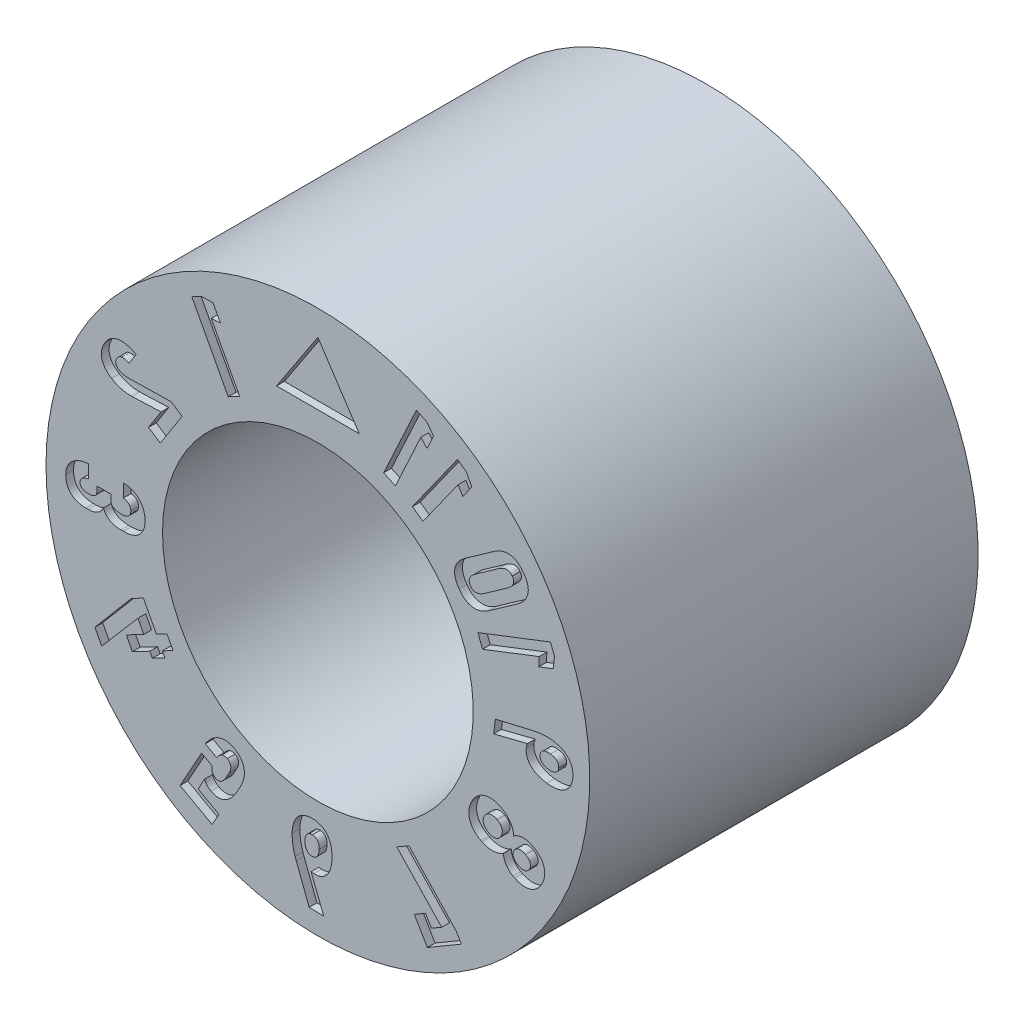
SolidWorks part; units mm, degrees
ref_plane "Front Plane" through (0, 0, 0) normal (0, 0, 1) x (1, 0, 0)
ref_plane "Top Plane" through (0, 0, 0) normal (0, 1, 0) x (1, 0, 0)
ref_plane "Right Plane" through (0, 0, 0) normal (1, 0, 0) x (0, 0, -1)
imported_body "Imported1"
other "Move Face1" parameters "D1"=0.22
other "DeleteFace2"
sketch "Sketch1" plane through (0, 0, 0) normal (0, 0, 1) x (1, 0, 0)
  line L0 (0, 0) -> (5.1041, 2.9469) construction
  line L1 (0, 0) -> (5.8937, 0) construction
  line L2 (0, 0) -> (5.1041, -2.9469) construction
  line L3 (0, 0) -> (2.9469, -5.1041) construction
  line L4 (0, 0) -> (0, -5.8937) construction
  line L5 (0, 0) -> (-2.9469, -5.1041) construction
  line L6 (0, 0) -> (-5.1041, -2.9469) construction
  line L7 (0, 0) -> (-5.8937, 0) construction
  line L8 (0, 0) -> (-5.1041, 2.9469) construction
  line L9 (0, 0) -> (-2.9469, 5.1041) construction
  line L10 (0, 0) -> (0, 5.8937) construction
  line L11 (0, 0) -> (2.9469, 5.1041) construction
  line L12 (2.0596, 0.9126) -> (2.1197, 0.7575)
  line L13 (2.1197, 0.7575) -> (2.8475, 1.0395)
  line L14 (2.8475, 1.0395) -> (2.8431, 0.9225)
  line L15 (2.8431, 0.9225) -> (3.0303, 0.995)
  line L16 (3.0303, 0.995) -> (3.0457, 1.1423)
  line L17 (3.0457, 1.1423) -> (2.9943, 1.2749)
  line L18 (2.9943, 1.2749) -> (2.0596, 0.9126)
  line L19 (2.2015, 1.2279) -> (2.5719, 1.4891)
  line L20 (2.267, 1.9211) -> (1.8966, 1.66)
  line L21 (2.0317, 1.5515) -> (2.3238, 1.7575)
  line L22 (2.4366, 1.5976) -> (2.1446, 1.3916)
  line L23 (1.2165, 1.8962) -> (1.3528, 1.7993)
  line L24 (1.3528, 1.7993) -> (1.8046, 2.4341)
  line L25 (1.8046, 2.4341) -> (1.8657, 2.334)
  line L26 (1.8657, 2.334) -> (1.9819, 2.4971)
  line L27 (1.9819, 2.4971) -> (1.9132, 2.629)
  line L28 (1.9132, 2.629) -> (1.7969, 2.7117)
  line L29 (1.7969, 2.7117) -> (1.2165, 1.8962)
  line L30 (0.8469, 2.0879) -> (0.9985, 2.0175)
  line L31 (0.9985, 2.0175) -> (1.3262, 2.7243)
  line L32 (1.3262, 2.7243) -> (1.4052, 2.6369)
  line L33 (1.4052, 2.6369) -> (1.4894, 2.8185)
  line L34 (1.4894, 2.8185) -> (1.3975, 2.9354)
  line L35 (1.3975, 2.9354) -> (1.2679, 2.9955)
  line L36 (1.2679, 2.9955) -> (0.8469, 2.0879)
  line L37 (-1.1539, 1.9352) -> (-1.0071, 2.0134)
  line L38 (-1.0071, 2.0134) -> (-1.372, 2.6989)
  line L39 (-1.372, 2.6989) -> (-1.2558, 2.7085)
  line L40 (-1.2558, 2.7085) -> (-1.3495, 2.8848)
  line L41 (-1.3495, 2.8848) -> (-1.4972, 2.8823)
  line L42 (-1.4972, 2.8823) -> (-1.6225, 2.8155)
  line L43 (-1.6225, 2.8155) -> (-1.1539, 1.9352)
  line L44 (-1.8903, 1.5123) -> (-2.4338, 1.5014)
  line L45 (-2.5595, 1.5311) -> (-2.5608, 1.5319)
  line L46 (-2.4326, 1.6703) -> (-2.4323, 1.67)
  line L47 (-2.4323, 1.67) -> (-2.3405, 1.8135)
  line L48 (-2.3405, 1.8135) -> (-2.3408, 1.8138)
  line L49 (-2.6576, 1.391) -> (-2.657, 1.3907)
  line L50 (-2.3979, 1.3187) -> (-2.0188, 1.3335)
  line L51 (-2.0188, 1.3335) -> (-2.181, 1.0802)
  line L52 (-2.181, 1.0802) -> (-2.0279, 0.982)
  line L53 (-2.0279, 0.982) -> (-1.7471, 1.4206)
  line L54 (-1.7471, 1.4206) -> (-1.8903, 1.5123)
  line L55 (-2.5038, 0.301) -> (-2.5047, 0.1299)
  line L56 (-2.5227, -0.0611) -> (-2.5461, -0.0611)
  line L57 (-2.6647, 0.02) -> (-2.6644, 0.0944)
  line L58 (-2.6644, 0.0944) -> (-2.846, 0.0952)
  line L59 (-2.846, 0.0952) -> (-2.8463, 0.0208)
  line L60 (-2.9497, -0.0446) -> (-2.967, -0.0447)
  line L61 (-2.9517, 0.1182) -> (-2.951, 0.2888)
  line L62 (-2.9869, -0.2224) -> (-2.9568, -0.2225)
  line L63 (-2.5324, -0.2392) -> (-2.5023, -0.2393)
  line L64 (-2.3998, -0.9363) -> (-2.8705, -1.4918)
  line L65 (-2.8705, -1.4918) -> (-2.7826, -1.6597)
  line L66 (-2.7826, -1.6597) -> (-2.3158, -1.1144)
  line L67 (-2.3158, -1.1144) -> (-2.2263, -1.2853)
  line L68 (-2.1308, -1.4677) -> (-1.9694, -1.3832)
  line L69 (-1.9694, -1.3832) -> (-2.0017, -1.3216)
  line L70 (-2.2458, -0.8556) -> (-2.3998, -0.9363)
  line L71 (-2.4656, -1.3755) -> (-2.388, -1.5239)
  line L72 (-2.388, -1.5239) -> (-2.163, -1.4061)
  line L73 (-1.8648, -1.2499) -> (-1.9425, -1.1015)
  line L74 (-1.9425, -1.1015) -> (-2.0794, -1.1733)
  line L75 (-1.4487, -2.0806) -> (-1.449, -2.0813)
  line L76 (-1.449, -2.0813) -> (-1.304, -2.1615)
  line L77 (-1.304, -2.1615) -> (-1.3037, -2.1608)
  line L78 (-1.145, -2.2571) -> (-1.1854, -2.33)
  line L79 (-1.3618, -2.2833) -> (-1.4972, -2.2085)
  line L80 (-1.4972, -2.2085) -> (-1.7741, -2.7093)
  line L81 (-1.7741, -2.7093) -> (-1.3609, -2.9376)
  line L82 (-1.3609, -2.9376) -> (-1.2735, -2.7797)
  line L83 (-1.2735, -2.7797) -> (-1.5417, -2.6315)
  line L84 (-1.5417, -2.6315) -> (-1.4567, -2.4774)
  line L85 (-1.0404, -2.4102) -> (-1, -2.3372)
  line L86 (-0.332, -2.5204) -> (-0.332, -2.521)
  line L87 (-0.2788, -2.8001) -> (-0.1124, -3.2356)
  line L88 (-0.1124, -3.2356) -> (0.0751, -3.2409)
  line L89 (0.0751, -3.2409) -> (-0.0872, -2.8268)
  line L91 (0.1826, -2.539) -> (0.1826, -2.5384)
  line L92 (0.0172, -2.5221) -> (0.0174, -2.5227)
  line L93 (-0.1662, -2.517) -> (-0.1662, -2.5161)
  line L94 (1.7844, -2.5592) -> (1.1725, -1.9071)
  line L95 (1.1725, -1.9071) -> (1.0158, -1.9987)
  line L96 (1.0158, -1.9987) -> (1.594, -2.6053)
  line L97 (1.594, -2.6053) -> (1.4618, -2.6824)
  line L98 (1.4618, -2.6824) -> (1.3861, -2.553)
  line L99 (1.3861, -2.553) -> (1.2415, -2.6376)
  line L100 (1.2415, -2.6376) -> (1.4085, -2.9234)
  line L101 (1.4085, -2.9234) -> (1.8473, -2.6669)
  line L102 (1.8473, -2.6669) -> (1.7844, -2.5592)
  line L103 (2.0995, -1.3854) -> (2.1142, -1.3928)
  line L104 (2.5113, -1.5747) -> (2.5345, -1.5865)
  line L105 (2.7723, -1.1198) -> (2.7491, -1.108)
  line L106 (2.3685, -0.8935) -> (2.3538, -0.886)
  line L107 (2.3027, -1.0469) -> (2.3112, -1.0513)
  line L108 (2.2075, -1.2536) -> (2.1983, -1.2489)
  line L109 (2.6667, -1.2529) -> (2.6754, -1.2572)
  line L110 (2.5881, -1.4269) -> (2.5789, -1.4223)
  line L112 (2.9453, -0.3217) -> (2.9458, -0.3219)
  line L113 (3.0065, 0.1932) -> (3.0059, 0.1934)
  line L114 (2.729, 0.1652) -> (2.2849, 0.0609)
  line L115 (2.2849, 0.0609) -> (2.2631, -0.1145)
  line L116 (2.2631, -0.1145) -> (2.6988, -0.0049)
  line L117 (2.9939, 0.0266) -> (2.9947, 0.0266)
  line L118 (2.9711, -0.1568) -> (2.9705, -0.1566)
  line L119 (-2.2407, -1.2577) -> (-2.4656, -1.3755)
  line L120 (-2.0685, -1.1942) -> (-2.2458, -0.8556)
  line L121 (-2.0017, -1.3216) -> (-1.8648, -1.2499)
  line L122 (-2.163, -1.4061) -> (-2.1308, -1.4677)
  circle A0 centre (0, 0) radius 2.26 construction
  spline S0 degree 3 poles (1.8175, 1.2806) (1.8291, 1.2639) (1.8482, 1.2409) (1.8763, 1.2142) (1.898, 1.1981) (1.9203, 1.1845) (1.9436, 1.1744) (1.9676, 1.1668) (1.9924, 1.1624) (2.0176, 1.1608) (2.0432, 1.1621) (2.0691, 1.1663) (2.0953, 1.1729) (2.1216, 1.1827) (2.1582, 1.1993) (2.1842, 1.2159) (2.2015, 1.2279) knots 0 0 0 0 0.138223 0.202127 0.26303 0.321891 0.378837 0.435678 0.492307 0.549453 0.60742 0.666308 0.727523 0.790486 0.856773 1 1 1 1
  spline S1 degree 3 poles (2.5719, 1.4891) (2.5892, 1.5013) (2.6134, 1.5207) (2.6419, 1.5494) (2.6599, 1.5712) (2.6751, 1.5936) (2.6875, 1.6166) (2.697, 1.6404) (2.704, 1.6647) (2.7081, 1.6894) (2.7089, 1.7145) (2.7068, 1.7398) (2.7017, 1.7653) (2.6935, 1.7909) (2.6781, 1.8263) (2.6626, 1.8517) (2.651, 1.8683) knots 0 0 0 0 0.143936 0.210679 0.274525 0.335577 0.39443 0.45221 0.50914 0.565942 0.622178 0.679438 0.738053 0.798374 0.8621 1 1 1 1
  spline S2 degree 3 poles (2.651, 1.8683) (2.6391, 1.8848) (2.6206, 1.9083) (2.592, 1.9344) (2.5707, 1.951) (2.5483, 1.9643) (2.5254, 1.9751) (2.5014, 1.9824) (2.4768, 1.9871) (2.4517, 1.9888) (2.4262, 1.9877) (2.4003, 1.9835) (2.3741, 1.9767) (2.3476, 1.9671) (2.3108, 1.95) (2.2844, 1.9334) (2.267, 1.9211) knots 0 0 0 0 0.138285 0.201935 0.262466 0.32126 0.378216 0.434531 0.491022 0.547533 0.605259 0.664079 0.724843 0.788739 0.855272 1 1 1 1
  spline S3 degree 3 poles (1.8966, 1.66) (1.8794, 1.6476) (1.8549, 1.6284) (1.8264, 1.5997) (1.8087, 1.5777) (1.7932, 1.5556) (1.7808, 1.5325) (1.7713, 1.5087) (1.7643, 1.4844) (1.7605, 1.4597) (1.7594, 1.4346) (1.7615, 1.4093) (1.7669, 1.3838) (1.7749, 1.358) (1.7904, 1.3226) (1.8058, 1.2971) (1.8175, 1.2806) knots 0 0 0 0 0.144056 0.21075 0.274393 0.335517 0.394327 0.452064 0.508951 0.565796 0.621851 0.679069 0.737879 0.798524 0.862202 1 1 1 1
  spline S4 degree 3 poles (1.9654, 1.3849) (1.9563, 1.397) (1.9473, 1.4179) (1.9471, 1.4476) (1.9539, 1.4689) (1.9658, 1.4901) (1.9906, 1.5196) (2.0139, 1.5394) (2.0317, 1.5515) knots 0 0 0 0 0.222988 0.325304 0.431966 0.550057 0.682242 1 1 1 1
  spline S5 degree 3 poles (2.3238, 1.7575) (2.3413, 1.7699) (2.3676, 1.7856) (2.4038, 1.7986) (2.4276, 1.803) (2.45, 1.802) (2.4781, 1.7923) (2.4944, 1.7761) (2.503, 1.7639) knots 0 0 0 0 0.31819 0.449664 0.567045 0.673853 0.777329 1 1 1 1
  spline S6 degree 3 poles (2.503, 1.7639) (2.5115, 1.7517) (2.5216, 1.731) (2.521, 1.7014) (2.5144, 1.6801) (2.5025, 1.659) (2.4781, 1.6292) (2.4542, 1.61) (2.4366, 1.5976) knots 0 0 0 0 0.222263 0.325328 0.432124 0.549372 0.681391 1 1 1 1
  spline S7 degree 3 poles (2.1446, 1.3916) (2.1272, 1.379) (2.1008, 1.3636) (2.0647, 1.3501) (2.0407, 1.346) (2.0183, 1.3468) (1.9905, 1.357) (1.9737, 1.3723) (1.9654, 1.3849) knots 0 0 0 0 0.317667 0.449809 0.568102 0.674939 0.777435 1 1 1 1
  spline S8 degree 3 poles (-2.4338, 1.5014) (-2.4572, 1.5008) (-2.501, 1.5049) (-2.5424, 1.5201) (-2.5595, 1.5311) knots 0 0 0 0 0.536929 1 1 1 1
  spline S9 degree 3 poles (-2.5608, 1.5319) (-2.5709, 1.5385) (-2.5851, 1.5498) (-2.5967, 1.5698) (-2.6018, 1.585) (-2.6029, 1.6012) (-2.5996, 1.6247) (-2.5912, 1.6413) (-2.5845, 1.652) knots 0 0 0 0 0.263365 0.379677 0.493234 0.607245 0.727117 1 1 1 1
  spline S10 degree 3 poles (-2.5845, 1.652) (-2.5777, 1.6627) (-2.5644, 1.6769) (-2.5413, 1.688) (-2.5223, 1.6923) (-2.5017, 1.6925) (-2.4706, 1.6877) (-2.4478, 1.6781) (-2.4326, 1.6703) knots 0 0 0 0 0.225248 0.334561 0.44738 0.567858 0.697098 1 1 1 1
  spline S11 degree 3 poles (-2.3408, 1.8138) (-2.3664, 1.8283) (-2.4056, 1.8462) (-2.4593, 1.8617) (-2.4975, 1.8681) (-2.5344, 1.8697) (-2.5698, 1.8664) (-2.6034, 1.8586) (-2.635, 1.8459) (-2.6644, 1.8285) (-2.7013, 1.7993) (-2.7238, 1.7711) (-2.7369, 1.7509) knots 0 0 0 0 0.196899 0.287244 0.373418 0.455611 0.534164 0.610264 0.685866 0.761776 0.838126 1 1 1 1
  spline S12 degree 3 poles (-2.7369, 1.7509) (-2.7508, 1.7294) (-2.768, 1.696) (-2.7826, 1.6497) (-2.7878, 1.6164) (-2.7882, 1.5838) (-2.784, 1.552) (-2.7747, 1.5215) (-2.7604, 1.4922) (-2.7416, 1.4641) (-2.7092, 1.4277) (-2.6792, 1.4048) (-2.6576, 1.391) knots 0 0 0 0 0.183427 0.266802 0.346802 0.424263 0.499506 0.575107 0.651975 0.732263 0.816125 1 1 1 1
  spline S13 degree 3 poles (-2.657, 1.3907) (-2.6377, 1.3785) (-2.6076, 1.3622) (-2.565, 1.3452) (-2.5319, 1.3348) (-2.4982, 1.3267) (-2.4537, 1.3195) (-2.4201, 1.3182) (-2.3979, 1.3187) knots 0 0 0 0 0.250313 0.376091 0.5041 0.631293 0.756247 1 1 1 1
  spline S14 degree 3 poles (-2.2252, 0.0178) (-2.2251, 0.0431) (-2.2284, 0.0807) (-2.2424, 0.1279) (-2.2568, 0.1604) (-2.275, 0.1903) (-2.2974, 0.2169) (-2.3233, 0.2406) (-2.3533, 0.2606) (-2.3865, 0.2771) (-2.4363, 0.2941) (-2.4763, 0.2998) (-2.5038, 0.301) knots 0 0 0 0 0.170884 0.251894 0.331445 0.409877 0.486903 0.565434 0.646124 0.729112 0.814592 1 1 1 1
  spline S15 degree 3 poles (-2.5047, 0.1299) (-2.4949, 0.1288) (-2.4809, 0.1259) (-2.4636, 0.1195) (-2.452, 0.114) (-2.442, 0.107) (-2.4329, 0.0997) (-2.4254, 0.0911) (-2.4191, 0.0818) (-2.4141, 0.0717) (-2.4093, 0.0569) (-2.408, 0.045) (-2.408, 0.037) knots 0 0 0 0 0.197799 0.288205 0.373638 0.455965 0.53409 0.609983 0.685076 0.76067 0.837589 1 1 1 1
  spline S16 degree 3 poles (-2.408, 0.037) (-2.4082, 0.0228) (-2.4111, 0.0017) (-2.4247, -0.0222) (-2.4382, -0.0365) (-2.4549, -0.048) (-2.483, -0.059) (-2.5065, -0.0613) (-2.5227, -0.0611) knots 0 0 0 0 0.249982 0.362912 0.475786 0.591998 0.715765 1 1 1 1
  spline S17 degree 3 poles (-2.5461, -0.0611) (-2.5631, -0.0611) (-2.5873, -0.0587) (-2.6168, -0.0499) (-2.634, -0.0404) (-2.6481, -0.0289) (-2.6614, -0.0094) (-2.6649, 0.0082) (-2.6647, 0.02) knots 0 0 0 0 0.314658 0.447802 0.567895 0.67794 0.781079 1 1 1 1
  spline S18 degree 3 poles (-2.8463, 0.0208) (-2.8465, 0.0112) (-2.8492, -0.0037) (-2.8617, -0.0191) (-2.8738, -0.0286) (-2.889, -0.0359) (-2.9143, -0.0434) (-2.9352, -0.0445) (-2.9497, -0.0446) knots 0 0 0 0 0.212077 0.314905 0.425831 0.547439 0.681377 1 1 1 1
  spline S19 degree 3 poles (-2.967, -0.0447) (-2.9807, -0.0447) (-3.0004, -0.0428) (-3.0242, -0.0345) (-3.0382, -0.0258) (-3.0495, -0.0153) (-3.0601, 0.0025) (-3.0632, 0.0179) (-3.0629, 0.0284) knots 0 0 0 0 0.30162 0.431712 0.550476 0.661572 0.769065 1 1 1 1
  spline S20 degree 3 poles (-3.0629, 0.0284) (-3.0629, 0.0357) (-3.061, 0.0464) (-3.0557, 0.06) (-3.0498, 0.0696) (-3.0423, 0.0784) (-3.0335, 0.0866) (-3.0232, 0.094) (-3.0115, 0.1006) (-2.9983, 0.1063) (-2.9785, 0.1131) (-2.9627, 0.1167) (-2.9517, 0.1182) knots 0 0 0 0 0.139325 0.208052 0.279596 0.35394 0.429788 0.51113 0.597261 0.689146 0.78635 1 1 1 1
  spline S21 degree 3 poles (-2.951, 0.2888) (-2.9798, 0.2867) (-3.0216, 0.28) (-3.0739, 0.263) (-3.1089, 0.2471) (-3.1403, 0.2279) (-3.168, 0.2058) (-3.1917, 0.1808) (-3.2112, 0.153) (-3.2267, 0.1232) (-3.2415, 0.0803) (-3.2458, 0.0463) (-3.246, 0.0233) knots 0 0 0 0 0.196375 0.287327 0.374343 0.457998 0.53764 0.615312 0.69188 0.768102 0.843822 1 1 1 1
  spline S22 degree 3 poles (-3.246, 0.0233) (-3.2459, 0.005) (-3.2445, -0.0221) (-3.2372, -0.0566) (-3.23, -0.0802) (-3.2206, -0.1021) (-3.2089, -0.1223) (-3.1951, -0.1409) (-3.1793, -0.1579) (-3.1615, -0.173) (-3.1417, -0.186) (-3.1204, -0.1974) (-3.097, -0.2062) (-3.072, -0.2135) (-3.0352, -0.2205) (-3.0065, -0.2223) (-2.9869, -0.2224) knots 0 0 0 0 0.136021 0.199203 0.259815 0.317992 0.375128 0.431724 0.488506 0.545872 0.603904 0.663145 0.724276 0.788303 0.855124 1 1 1 1
  spline S23 degree 3 poles (-2.9568, -0.2225) (-2.9349, -0.2226) (-2.9027, -0.2195) (-2.8625, -0.2064) (-2.8354, -0.193) (-2.8109, -0.1761) (-2.7825, -0.1484) (-2.7663, -0.1231) (-2.7581, -0.1048) knots 0 0 0 0 0.267864 0.392553 0.515693 0.636182 0.75559 1 1 1 1
  spline S24 degree 3 poles (-2.7581, -0.1048) (-2.7554, -0.1151) (-2.7503, -0.1302) (-2.7403, -0.1487) (-2.7315, -0.1616) (-2.7214, -0.1736) (-2.7099, -0.1846) (-2.6971, -0.1948) (-2.678, -0.2072) (-2.6512, -0.2202) (-2.601, -0.2352) (-2.5604, -0.2389) (-2.5324, -0.2392) knots 0 0 0 0 0.112513 0.167441 0.22159 0.276546 0.332896 0.390174 0.448904 0.572816 0.703834 1 1 1 1
  spline S25 degree 3 poles (-2.5023, -0.2393) (-2.4752, -0.2395) (-2.4355, -0.2366) (-2.3859, -0.2236) (-2.3531, -0.2105) (-2.3236, -0.1938) (-2.2978, -0.1734) (-2.2757, -0.1493) (-2.2575, -0.1218) (-2.2431, -0.0911) (-2.2289, -0.0448) (-2.2253, -0.0076) (-2.2252, 0.0178) knots 0 0 0 0 0.189541 0.275648 0.357338 0.435385 0.511642 0.586239 0.662707 0.741054 0.822273 1 1 1 1
  spline S26 degree 3 poles (-1.0793, -1.9447) (-1.0991, -1.9338) (-1.1305, -1.9209) (-1.1746, -1.9139) (-1.2077, -1.9135) (-1.241, -1.9175) (-1.2738, -1.9267) (-1.306, -1.941) (-1.3374, -1.9598) (-1.3679, -1.9833) (-1.4075, -2.022) (-1.4332, -2.056) (-1.4487, -2.0806) knots 0 0 0 0 0.154801 0.229683 0.305088 0.381101 0.458281 0.537806 0.621617 0.709067 0.800913 1 1 1 1
  spline S27 degree 3 poles (-1.3037, -2.1608) (-1.2946, -2.1469) (-1.2791, -2.1285) (-1.2551, -2.1096) (-1.2371, -2.1003) (-1.2189, -2.0946) (-1.194, -2.0935) (-1.1759, -2.099) (-1.1651, -2.1052) knots 0 0 0 0 0.30142 0.431347 0.552466 0.666341 0.774979 1 1 1 1
  spline S28 degree 3 poles (-1.1651, -2.1052) (-1.1537, -2.1115) (-1.138, -2.1241) (-1.1257, -2.1471) (-1.1211, -2.1662) (-1.1205, -2.1871) (-1.1262, -2.2186) (-1.1366, -2.2417) (-1.145, -2.2571) knots 0 0 0 0 0.228345 0.335792 0.447196 0.566011 0.695359 1 1 1 1
  spline S29 degree 3 poles (-1.1854, -2.33) (-1.1939, -2.3453) (-1.2076, -2.3664) (-1.2305, -2.3883) (-1.2473, -2.3995) (-1.2645, -2.4065) (-1.2883, -2.4087) (-1.3058, -2.4041) (-1.316, -2.3979) knots 0 0 0 0 0.317961 0.451111 0.571891 0.682328 0.785376 1 1 1 1
  spline S30 degree 3 poles (-1.316, -2.3979) (-1.3256, -2.3923) (-1.3393, -2.3826) (-1.3525, -2.3651) (-1.3597, -2.3508) (-1.3645, -2.3352) (-1.3669, -2.3124) (-1.3647, -2.2949) (-1.3618, -2.2833) knots 0 0 0 0 0.2508 0.368564 0.487845 0.609408 0.732715 1 1 1 1
  spline S31 degree 3 poles (-1.4567, -2.4774) (-1.4545, -2.4868) (-1.449, -2.5007) (-1.438, -2.518) (-1.428, -2.531) (-1.4165, -2.5433) (-1.3999, -2.5575) (-1.3869, -2.5673) (-1.3773, -2.5722) knots 0 0 0 0 0.227991 0.350069 0.48241 0.61661 0.745694 1 1 1 1
  spline S32 degree 3 poles (-1.3773, -2.5722) (-1.3586, -2.5825) (-1.329, -2.5945) (-1.2876, -2.5997) (-1.2574, -2.5986) (-1.2274, -2.5922) (-1.1982, -2.5804) (-1.1693, -2.5641) (-1.1414, -2.5424) (-1.1143, -2.5161) (-1.0782, -2.4732) (-1.0549, -2.4364) (-1.0404, -2.4102) knots 0 0 0 0 0.152248 0.224027 0.294817 0.366823 0.440565 0.518443 0.601923 0.6913 0.786668 1 1 1 1
  spline S33 degree 3 poles (-1, -2.3372) (-0.9856, -2.311) (-0.9671, -2.2713) (-0.9523, -2.2169) (-0.9462, -2.1788) (-0.9456, -2.1421) (-0.9494, -2.1071) (-0.959, -2.0742) (-0.9732, -2.0432) (-0.9925, -2.0145) (-1.0259, -1.9786) (-1.0568, -1.9569) (-1.0793, -1.9447) knots 0 0 0 0 0.198011 0.287205 0.371812 0.452182 0.528627 0.603302 0.677465 0.752855 0.830889 1 1 1 1
  spline S34 degree 3 poles (-0.0665, -2.2257) (-0.0918, -2.2247) (-0.129, -2.2278) (-0.1756, -2.2414) (-0.2066, -2.2564) (-0.2345, -2.2756) (-0.2592, -2.2989) (-0.2803, -2.3265) (-0.298, -2.3582) (-0.3123, -2.3936) (-0.327, -2.4476) (-0.3308, -2.4908) (-0.332, -2.5204) knots 0 0 0 0 0.168783 0.246857 0.322466 0.397014 0.471656 0.547898 0.628096 0.712729 0.802078 1 1 1 1
  spline S35 degree 3 poles (-0.332, -2.521) (-0.3325, -2.5397) (-0.3316, -2.5682) (-0.328, -2.6067) (-0.3188, -2.6681) (-0.3067, -2.719) (-0.2934, -2.759) knots 0 0 0 0 0.231402 0.353128 0.478528 1 1 1 1
  spline S36 degree 3 poles (-0.2934, -2.759) (-0.2914, -2.7661) (-0.2864, -2.7797) (-0.2816, -2.7934) (-0.2788, -2.8001) knots 0 0 0 0 0.503759 1 1 1 1
  spline S37 degree 3 poles (-0.0872, -2.8268) (-0.0767, -2.8294) (-0.0658, -2.8305) (-0.0551, -2.831) knots 0.766156 0.766156 0.766156 0.766156 1 1 1 1
  spline S38 degree 3 poles (-0.0551, -2.831) (-0.0325, -2.8314) (0.0012, -2.8291) (0.0427, -2.815) (0.0706, -2.8005) (0.0954, -2.7813) (0.1176, -2.7581) (0.1363, -2.7306) (0.1522, -2.6993) (0.1647, -2.6641) (0.178, -2.6108) (0.1814, -2.5682) (0.1826, -2.539) knots 0 0 0 0 0.159665 0.233922 0.307095 0.380353 0.454338 0.531615 0.613645 0.70097 0.79394 1 1 1 1
  spline S39 degree 3 poles (0.1826, -2.5384) (0.1835, -2.5085) (0.1816, -2.4647) (0.1702, -2.4094) (0.1582, -2.3727) (0.142, -2.3397) (0.1225, -2.3105) (0.099, -2.2855) (0.0723, -2.2646) (0.042, -2.248) (-0.0038, -2.2314) (-0.041, -2.2263) (-0.0665, -2.2257) knots 0 0 0 0 0.198272 0.288078 0.372761 0.453234 0.530156 0.604522 0.678801 0.753963 0.831855 1 1 1 1
  spline S40 degree 3 poles (-0.0715, -2.4073) (-0.0583, -2.4076) (-0.0387, -2.4113) (-0.0166, -2.4246) (-0.0036, -2.4382) (0.0066, -2.4549) (0.0161, -2.4829) (0.0176, -2.5061) (0.0172, -2.5221) knots 0 0 0 0 0.241904 0.352713 0.464932 0.582425 0.707323 1 1 1 1
  spline S41 degree 3 poles (0.0174, -2.5227) (0.017, -2.5411) (0.0137, -2.5674) (0.0027, -2.5989) (-0.0084, -2.6174) (-0.0224, -2.6319) (-0.0448, -2.6461) (-0.0651, -2.6491) (-0.0784, -2.6488) knots 0 0 0 0 0.309811 0.439793 0.558761 0.668816 0.775224 1 1 1 1
  spline S42 degree 3 poles (-0.0784, -2.6488) (-0.0915, -2.6482) (-0.1115, -2.6443) (-0.1329, -2.6285) (-0.1459, -2.6129) (-0.1555, -2.5934) (-0.1658, -2.5616) (-0.1662, -2.5351) (-0.1662, -2.517) knots 0 0 0 0 0.223451 0.329309 0.440847 0.561748 0.692669 1 1 1 1
  spline S43 degree 3 poles (-0.1662, -2.5161) (-0.1656, -2.5002) (-0.1629, -2.4772) (-0.1515, -2.4501) (-0.1405, -2.4341) (-0.1267, -2.4216) (-0.1043, -2.4092) (-0.0846, -2.407) (-0.0715, -2.4073) knots 0 0 0 0 0.293828 0.418443 0.535396 0.647352 0.757693 1 1 1 1
  spline S44 degree 3 poles (1.9795, -1.0098) (1.9676, -1.0334) (1.953, -1.0698) (1.944, -1.1201) (1.9423, -1.1564) (1.9455, -1.1919) (1.9537, -1.226) (1.9668, -1.2584) (1.9849, -1.2889) (2.007, -1.3175) (2.0435, -1.3526) (2.0762, -1.3734) (2.0995, -1.3854) knots 0 0 0 0 0.178904 0.262277 0.343871 0.423875 0.501818 0.579804 0.659084 0.74032 0.823197 1 1 1 1
  spline S45 degree 3 poles (2.1142, -1.3928) (2.136, -1.4038) (2.1705, -1.4168) (2.2191, -1.4239) (2.2558, -1.4248) (2.2922, -1.4214) (2.3381, -1.4107) (2.3697, -1.3954) (2.3888, -1.3825) knots 0 0 0 0 0.254555 0.380794 0.510158 0.637489 0.760373 1 1 1 1
  spline S46 degree 3 poles (2.3888, -1.3825) (2.3894, -1.4021) (2.3944, -1.4315) (2.4088, -1.4686) (2.4237, -1.495) (2.4414, -1.5196) (2.4689, -1.5487) (2.4938, -1.5654) (2.5113, -1.5747) knots 0 0 0 0 0.246588 0.371108 0.498461 0.62659 0.751508 1 1 1 1
  spline S47 degree 3 poles (2.5345, -1.5865) (2.5565, -1.5976) (2.5906, -1.6108) (2.6376, -1.6195) (2.6717, -1.6208) (2.7048, -1.6173) (2.7369, -1.6099) (2.7672, -1.5972) (2.796, -1.5804) (2.8228, -1.5594) (2.8561, -1.5251) (2.8756, -1.4941) (2.8869, -1.4721) knots 0 0 0 0 0.177626 0.260887 0.342289 0.421964 0.499708 0.578138 0.657657 0.738797 0.822075 1 1 1 1
  spline S48 degree 3 poles (2.8869, -1.4721) (2.8983, -1.4502) (2.9116, -1.416) (2.9199, -1.3689) (2.9213, -1.3348) (2.9179, -1.3017) (2.9102, -1.2697) (2.8976, -1.2393) (2.8807, -1.2105) (2.8595, -1.1839) (2.8252, -1.1506) (2.7943, -1.131) (2.7723, -1.1198) knots 0 0 0 0 0.177737 0.261306 0.342676 0.422322 0.49985 0.578251 0.65774 0.739356 0.822122 1 1 1 1
  spline S49 degree 3 poles (2.7491, -1.108) (2.7312, -1.0987) (2.7025, -1.0888) (2.6625, -1.0833) (2.6321, -1.0837) (2.6021, -1.0879) (2.5637, -1.0986) (2.5371, -1.1121) (2.5209, -1.1233) knots 0 0 0 0 0.251562 0.375939 0.503229 0.630153 0.754335 1 1 1 1
  spline S50 degree 3 poles (2.5209, -1.1233) (2.5204, -1.1) (2.5133, -1.0655) (2.4957, -1.0214) (2.4771, -0.9898) (2.4552, -0.9602) (2.4205, -0.9256) (2.3906, -0.9042) (2.3685, -0.8935) knots 0 0 0 0 0.241042 0.364017 0.491835 0.620377 0.746119 1 1 1 1
  spline S51 degree 3 poles (2.3538, -0.886) (2.3306, -0.8739) (2.2943, -0.8604) (2.2446, -0.8512) (2.2085, -0.8499) (2.1732, -0.8534) (2.1393, -0.8621) (2.1069, -0.8754) (2.0764, -0.8936) (2.048, -0.9163) (2.0126, -0.9532) (1.9917, -0.9863) (1.9795, -1.0098) knots 0 0 0 0 0.176841 0.259596 0.34065 0.420218 0.498269 0.576175 0.655897 0.737657 0.821095 1 1 1 1
  spline S52 degree 3 poles (2.141, -1.092) (2.1457, -1.0825) (2.1546, -1.0695) (2.1693, -1.0548) (2.1816, -1.046) (2.1947, -1.039) (2.2087, -1.0339) (2.2235, -1.0311) (2.2389, -1.0299) (2.2548, -1.0311) (2.2766, -1.0354) (2.2924, -1.0416) (2.3027, -1.0469) knots 0 0 0 0 0.168267 0.249136 0.329126 0.407702 0.485357 0.565157 0.646738 0.731163 0.816824 1 1 1 1
  spline S53 degree 3 poles (2.3112, -1.0513) (2.3205, -1.0563) (2.3339, -1.0645) (2.3485, -1.079) (2.3577, -1.0904) (2.3647, -1.103) (2.37, -1.1161) (2.3733, -1.1299) (2.375, -1.1441) (2.374, -1.1589) (2.3708, -1.1793) (2.3643, -1.1939) (2.3598, -1.2036) knots 0 0 0 0 0.176909 0.259557 0.341151 0.420926 0.499192 0.576361 0.655991 0.737334 0.821404 1 1 1 1
  spline S54 degree 3 poles (2.3598, -1.2036) (2.3549, -1.213) (2.3466, -1.2267) (2.332, -1.2412) (2.3206, -1.2504) (2.3082, -1.2576) (2.295, -1.2631) (2.2812, -1.2667) (2.2667, -1.2679) (2.252, -1.2675) (2.2316, -1.264) (2.2169, -1.2584) (2.2075, -1.2536) knots 0 0 0 0 0.178019 0.261603 0.341893 0.421375 0.499202 0.578298 0.658325 0.739681 0.82357 1 1 1 1
  spline S55 degree 3 poles (2.1983, -1.2489) (2.1882, -1.2434) (2.1734, -1.2348) (2.1576, -1.2192) (2.1474, -1.2072) (2.1392, -1.1942) (2.1331, -1.1806) (2.1292, -1.1663) (2.1272, -1.1516) (2.1277, -1.1367) (2.1306, -1.1162) (2.1364, -1.1015) (2.141, -1.092) knots 0 0 0 0 0.184102 0.270137 0.35391 0.435516 0.5143 0.591938 0.671132 0.75017 0.830781 1 1 1 1
  spline S56 degree 3 poles (2.5225, -1.2864) (2.5266, -1.2783) (2.5342, -1.2672) (2.547, -1.2551) (2.5577, -1.2478) (2.5694, -1.2425) (2.5817, -1.2384) (2.5949, -1.2368) (2.6086, -1.2362) (2.6229, -1.2379) (2.6427, -1.2422) (2.6572, -1.2482) (2.6667, -1.2529) knots 0 0 0 0 0.16281 0.240649 0.317907 0.394107 0.471627 0.550577 0.633527 0.71944 0.807996 1 1 1 1
  spline S57 degree 3 poles (2.6754, -1.2572) (2.6841, -1.2618) (2.6967, -1.2694) (2.7106, -1.2825) (2.7194, -1.2926) (2.7262, -1.3036) (2.7316, -1.315) (2.7352, -1.327) (2.7371, -1.3393) (2.7371, -1.352) (2.7346, -1.3693) (2.7297, -1.3818) (2.7256, -1.3898) knots 0 0 0 0 0.186675 0.273841 0.357103 0.437726 0.517127 0.594277 0.671964 0.750652 0.831033 1 1 1 1
  spline S58 degree 3 poles (2.7256, -1.3898) (2.7213, -1.3978) (2.7142, -1.4091) (2.7017, -1.4214) (2.6915, -1.4288) (2.6803, -1.4345) (2.6686, -1.4389) (2.656, -1.4409) (2.643, -1.4416) (2.6294, -1.4406) (2.6107, -1.4368) (2.597, -1.4313) (2.5881, -1.4269) knots 0 0 0 0 0.169683 0.248098 0.326945 0.404102 0.482187 0.560105 0.641942 0.726777 0.81318 1 1 1 1
  spline S59 degree 3 poles (2.5789, -1.4223) (2.5698, -1.4173) (2.5565, -1.4095) (2.5416, -1.396) (2.5323, -1.3853) (2.5246, -1.374) (2.5185, -1.3623) (2.5145, -1.35) (2.5121, -1.3374) (2.5116, -1.3245) (2.5138, -1.307) (2.5184, -1.2944) (2.5225, -1.2864) knots 0 0 0 0 0.188694 0.278314 0.363849 0.44663 0.525408 0.603134 0.681026 0.758437 0.836202 1 1 1 1
  spline S60 degree 3 poles (2.6988, -0.0049) (2.6984, -0.0056) (2.6955, -0.0118) (2.6885, -0.0306) (2.6838, -0.0493) (2.6826, -0.0625) knots 0.575745 0.575745 0.575745 0.575745 0.592683 0.721734 1 1 1 1
  spline S61 degree 3 poles (2.6826, -0.0625) (2.6801, -0.0835) (2.6801, -0.1155) (2.691, -0.156) (2.7036, -0.1844) (2.7206, -0.2108) (2.7419, -0.235) (2.7674, -0.2565) (2.7964, -0.2758) (2.8292, -0.2921) (2.8783, -0.3105) (2.918, -0.3184) (2.9453, -0.3217) knots 0 0 0 0 0.154179 0.22853 0.302974 0.378646 0.455896 0.535694 0.619879 0.708253 0.800517 1 1 1 1
  spline S62 degree 3 poles (2.9458, -0.3219) (2.9756, -0.3257) (3.0194, -0.3278) (3.0756, -0.3217) (3.1133, -0.3129) (3.1476, -0.3001) (3.1786, -0.2833) (3.2055, -0.2621) (3.229, -0.2373) (3.2484, -0.2086) (3.2697, -0.1643) (3.2777, -0.1272) (3.281, -0.1018) knots 0 0 0 0 0.197929 0.287349 0.372076 0.452203 0.528573 0.602926 0.677307 0.752682 0.830849 1 1 1 1
  spline S63 degree 3 poles (3.281, -0.1018) (3.2844, -0.0766) (3.2848, -0.039) (3.2754, 0.0091) (3.2632, 0.0416) (3.2463, 0.0715) (3.2248, 0.0986) (3.1988, 0.1227) (3.1682, 0.1435) (3.1335, 0.1613) (3.0799, 0.1808) (3.0366, 0.1896) (3.0065, 0.1932) knots 0 0 0 0 0.167016 0.244601 0.319928 0.394364 0.469103 0.545937 0.626361 0.711054 0.801217 1 1 1 1
  spline S64 degree 3 poles (3.0059, 0.1934) (2.9886, 0.1957) (2.962, 0.1969) (2.9256, 0.1964) (2.8966, 0.1944) (2.8663, 0.191) (2.8232, 0.185) (2.7905, 0.1782) (2.7682, 0.1738) knots 0 0 0 0 0.218164 0.333506 0.455095 0.582133 0.715293 1 1 1 1
  spline S65 degree 3 poles (2.7682, 0.1738) (2.7616, 0.1724) (2.7483, 0.1706) (2.7355, 0.1666) (2.729, 0.1652) knots 0 0 0 0 0.504542 1 1 1 1
  spline S66 degree 3 poles (2.8613, -0.0496) (2.8626, -0.0363) (2.8689, -0.0172) (2.8854, 0.0032) (2.9014, 0.0147) (2.9204, 0.0232) (2.9516, 0.0297) (2.9767, 0.0286) (2.9939, 0.0266) knots 0 0 0 0 0.231162 0.339328 0.450782 0.56923 0.698463 1 1 1 1
  spline S67 degree 3 poles (2.9947, 0.0266) (3.0112, 0.0243) (3.035, 0.0194) (3.0623, 0.0053) (3.0781, -0.0074) (3.0899, -0.0225) (3.101, -0.0461) (3.1012, -0.0662) (3.0999, -0.0792) knots 0 0 0 0 0.297809 0.42585 0.54313 0.655016 0.765008 1 1 1 1
  spline S68 degree 3 poles (3.0999, -0.0792) (3.0982, -0.0925) (3.0925, -0.112) (3.0764, -0.1327) (3.0608, -0.1444) (3.0423, -0.1528) (3.0121, -0.1598) (2.9878, -0.1589) (2.9711, -0.1568) knots 0 0 0 0 0.23773 0.346526 0.45815 0.576506 0.703417 1 1 1 1
  spline S69 degree 3 poles (2.9705, -0.1566) (2.9535, -0.1542) (2.9287, -0.1496) (2.9004, -0.135) (2.884, -0.1224) (2.8715, -0.1072) (2.8605, -0.0832) (2.8594, -0.0629) (2.8613, -0.0496) knots 0 0 0 0 0.300803 0.42902 0.5476 0.657795 0.766642 1 1 1 1
  point P19 (0, 0)
  dimension "D1" = 4.52
  dimension "D2" = 12
extrude "Cut-Extrude1" cut sketch "Sketch1" against normal blind 0.1
